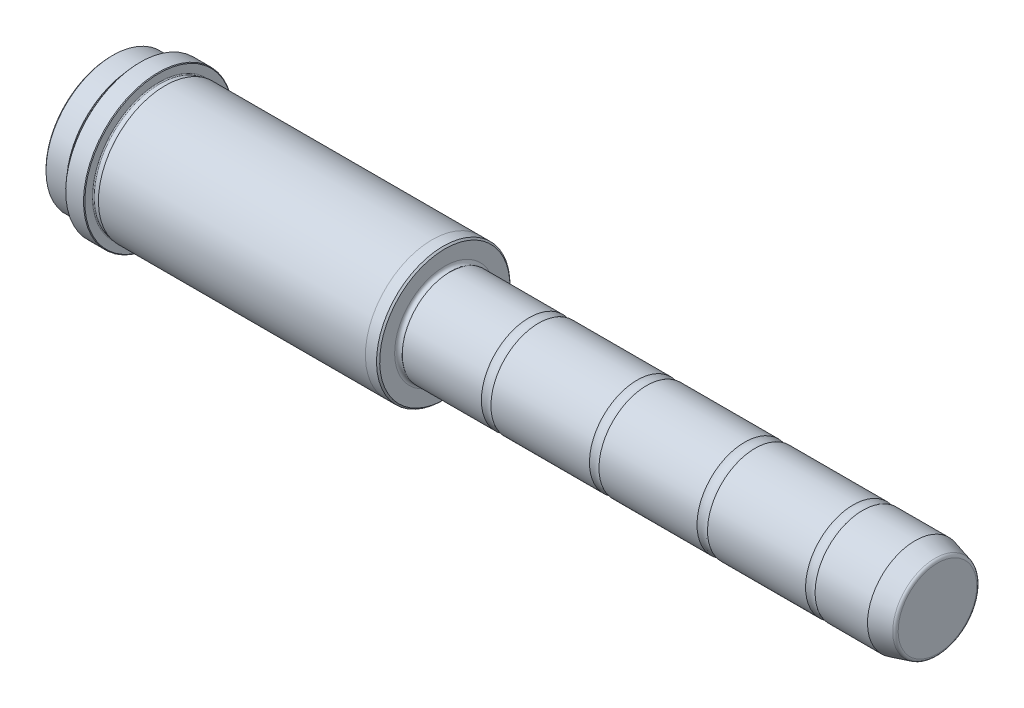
SolidWorks part; units mm, degrees
ref_plane "Front Plane" through (0, 0, 0) normal (0, 0, 1) x (1, 0, 0)
ref_plane "Top Plane" through (0, 0, 0) normal (0, 1, 0) x (1, 0, 0)
ref_plane "Right Plane" through (0, 0, 0) normal (1, 0, 0) x (0, 0, -1)
sketch "Sketch1" plane through (0, 0, 0) normal (0, 0, 1) x (1, 0, 0)
  line L0 (155, 13.1244) -> (148, 15)
  line L1 (148, 15) -> (1.6, 15)
  line L2 (0, 15.8) -> (0, 21)
  line L3 (0, 21) -> (-4, 21)
  line L4 (-88, 21.0001) -> (-88, 20.9)
  line L5 (-88.3, 20.6) -> (-89.7, 20.6)
  line L6 (-90, 20.9) -> (-90, 23.5)
  line L7 (-90, 23.5) -> (-96, 23.5)
  line L8 (-96, 23.5) -> (-96, 20.9)
  line L9 (-96.3, 20.6) -> (-97.7, 20.6)
  line L10 (-98, 20.9) -> (-98, 21)
  line L11 (-98, 21) -> (-105, 21)
  line L12 (-105, 21) -> (-105, 0)
  line L13 (155, 13.1244) -> (155, 0)
  line L14 (155, 0) -> (-155, 0) construction
  line L15 (155, 0) -> (-105, 0)
  line L16 (-4, 21.0001) -> (-88, 21.0001)
  line L17 (-4, 21.0001) -> (-4, 21)
  arc A0 (0, 15.8) -> (1.6, 15) centre (1, 15.8) ccw
  arc A1 (-96, 20.9) -> (-96.3, 20.6) centre (-96.3, 20.9) cw
  arc A2 (-97.7, 20.6) -> (-98, 20.9) centre (-97.7, 20.9) cw
  arc A3 (-89.7, 20.6) -> (-90, 20.9) centre (-89.7, 20.9) cw
  arc A4 (-88, 20.9) -> (-88.3, 20.6) centre (-88.3, 20.9) cw
  point P16 (0, 0)
  point P28 (-90, 20.6)
  point P31 (-88, 20.6)
  dimension "ShoulderRadii" = 2
  dimension "D5" = 0.3
  dimension "D1" = 15
  dimension "D2" = 0.4
  dimension "PinDia" = 30
  dimension "ChamferLeadIn" = 7
  dimension "ShoulderDia" = 42
  dimension "PinLengthN" = 155
  dimension "ShoulderLength" = 96
  dimension "D3" = 0.0001
  dimension "ShoulderGap" = 2
  dimension "D4" = 4
  dimension "T" = 6
  dimension "CollarLength" = 9
  dimension "HeadDia" = 47
  dimension "D8" = 0.2
revolve "Revolve1" add sketch "Sketch1" angle 360 about L14
sketch "Sketch2" plane through (0, 0, 0) normal (0, 0, 1) x (1, 0, 0)
  line L0 (155, -13.1244) -> (155, 13.1244) construction
  line L1 (145.9417, 14.6) -> (148.0583, 14.6) construction
  line L2 (148, 15) -> (1.6, 15) construction
  line L4 (128.5033, 15) -> (131.4967, 15)
  arc A0 (128.5033, 15) -> (131.4967, 15) centre (130, 17.6) ccw
  dimension "GrooveRadius" = 3
  dimension "D3" = 0.4
  dimension "AGroove" = 25
revolve "Groove A" cut sketch "Sketch2" angle 360 about axis through (155, 0, 0) along (1, 0, 0)
sketch "Sketch3" plane through (0, 0, 0) normal (0, 0, 1) x (1, 0, 0)
  line L0 (128.5033, 15) -> (1.6, 15) construction
  line L3 (94.3417, 15) -> (97.6583, 15)
  arc A0 (94.3417, 15) -> (97.6583, 15) centre (96, 17.5) ccw
  arc A1 (128.5033, 15) -> (131.4967, 15) centre (130, 17.6) ccw construction
  dimension "D1" = 0.5
  dimension "GroovePitch" = 34
revolve "Groove B" cut sketch "Sketch3" angle 360 about axis through (155, 0, 0) along (1, 0, 0)
sketch "Sketch4" plane through (0, 0, 0) normal (0, 0, 1) x (1, 0, 0)
  line L2 (94.3417, 15) -> (1.6, 15) construction
  line L3 (60.5033, 15) -> (63.4967, 15)
  arc A0 (60.5033, 15) -> (63.4967, 15) centre (62, 17.6) ccw
  arc A3 (94.3417, 15) -> (97.6583, 15) centre (96, 17.5) ccw construction
  dimension "D1" = 0.4
revolve "Groove C" cut sketch "Sketch4" angle 360 about axis through (155, 0, 0) along (1, 0, 0)
sketch "Sketch5" plane through (0, 0, 0) normal (0, 0, 1) x (1, 0, 0)
  line L0 (26.5033, 15) -> (29.4967, 15)
  line L1 (60.5033, 15) -> (1.6, 15) construction
  arc A0 (26.5033, 15) -> (29.4967, 15) centre (28, 17.6) ccw
  arc A3 (60.5033, 15) -> (63.4967, 15) centre (62, 17.6) ccw construction
  dimension "D1" = 0.4
revolve "Groove D" cut sketch "Sketch5" angle 360 about axis through (155, 0, 0) along (1, 0, 0)
fillet "Fillet1" radius 1 1 edges at (155, 13.1244, 0)
chamfer "Chamfer1" distance 0.2 angle 45 2 edges at (-96, 23.5, 0) (-90, 23.5, 0)
chamfer "Chamfer2" distance 0.5 angle 45 2 edges at (-105, 21, 0) (0, 21, 0)
